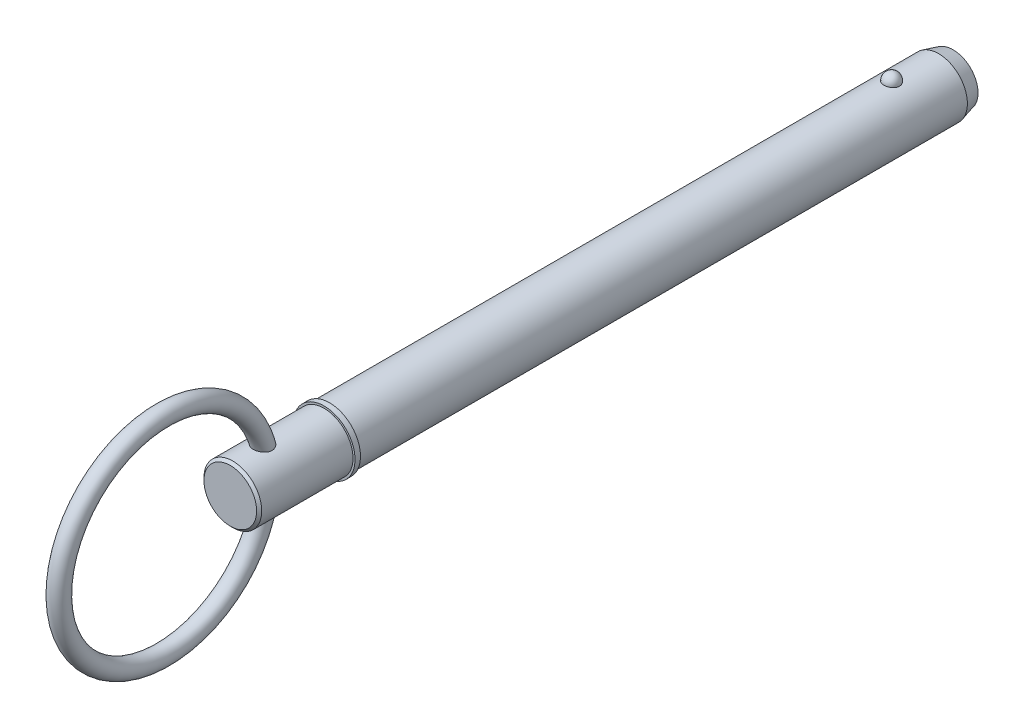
SolidWorks part; units mm, degrees
ref_plane "Front Plane" through (0, 0, 0) normal (0, 0, 1) x (1, 0, 0)
ref_plane "Top Plane" through (0, 0, 0) normal (0, 1, 0) x (1, 0, 0)
ref_plane "Right Plane" through (0, 0, 0) normal (1, 0, 0) x (0, 0, -1)
sketch "Sketch2" plane through (0, 0, 0) normal (0, 0, 1) x (1, 0, 0)
  circle A0 centre (0, 0) radius 7.94
  point P3 (0, 7.94)
  dimension "D1" = 15.88
extrude "Boss-Extrude1" add sketch "Sketch2" along normal blind 152.4
sketch "Sketch3" plane through (0, 0, 0) normal (0, 0, -1) x (-1, 0, 0)
  circle A0 centre (0, 0) radius 7.94
  dimension "D1" = 15.88
extrude "Boss-Extrude2" add sketch "Sketch3" along normal blind 19.05
chamfer "Chamfer1" distance 4 angle 15 1 edges at (-7.94, 0, -19.05)
sketch "Sketch18" plane through (0, 0, 0) normal (1, 0, 0) x (0, 0, -1)
  line L0 (15.05, 7.94) -> (-152.4, 7.94) construction
  line L1 (2.15, 10.09) -> (2.15, 5.79)
  line L2 (-152.4, -7.94) -> (15.05, -7.94) construction
  arc A0 (2.15, 10.09) -> (2.15, 5.79) centre (2.15, 7.94) ccw
  point P4 (0, 7.94)
  dimension "D1" = 18.03
revolve "Revolve1" add sketch "Sketch18" angle 360 about L1
sketch "Sketch19" plane through (0, 0, 0) normal (1, 0, 0) x (0, 0, -1)
  line L0 (-33.7288, 0) -> (-46.4542, 0) construction
sketch "Sketch20" plane through (0, 0, 0) normal (1, 0, 0) x (0, 0, -1)
  line L0 (-152.4, 0) -> (-152.4, 8.5)
  line L1 (-152.4, 7.94) -> (-152.4, -7.94) construction
  line L2 (-152.4, 8.5) -> (-153.9, 8.5)
  line L3 (-153.9, 8.5) -> (-153.9, 0)
  line L4 (-33.7288, 0) -> (-46.4542, 0) construction
  line L5 (-153.9, 0) -> (-152.4, 0)
  dimension "D1" = 8.5
  dimension "D2" = 1.5
revolve "Revolve2" add sketch "Sketch20" angle 360 about L0
sketch "Sketch21" plane through (0, 0, 152.4) normal (0, 0, -1) x (-1, 0, 0)
  circle A0 centre (0, 0) radius 7.94
  dimension "D1" = 15.88
extrude "Boss-Extrude3" add sketch "Sketch21" against normal blind 27.31
chamfer "Chamfer2" distance 0.7 angle 45 1 edges at (-7.94, 0, 179.71)
sketch "Sketch23" plane through (0, 0, 0) normal (1, 0, 0) x (0, 0, -1)
  line L0 (-179.71, 7.24) -> (-179.71, -7.24) construction
  circle A0 centre (-198.285, 0) radius 28.575
  point P2 (-169.71, 0)
  dimension "D1" = 57.15
  dimension "D2" = 10
sketch "Sketch24" plane through (0, 0, 0) normal (0, 1, 0) x (1, 0, 0)
  circle A0 centre (0, -169.71) radius 2.5
  dimension "D1" = 5
sweep "Sweep1" add profiles "Sketch24" path "Sketch23"
